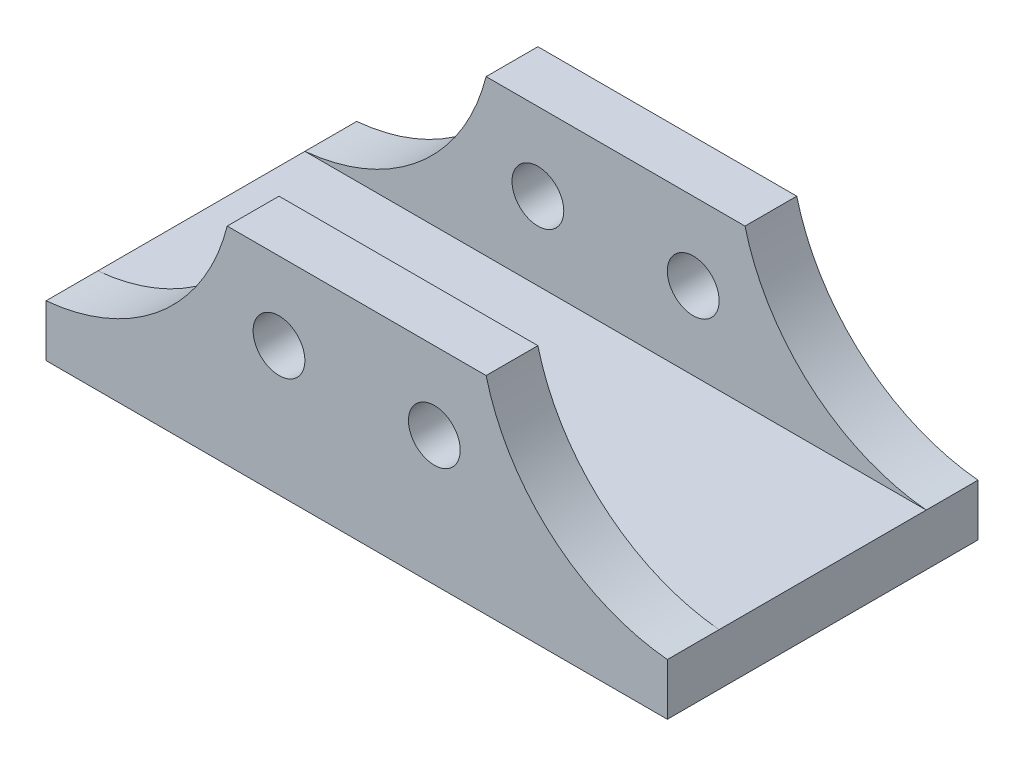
SolidWorks part; units mm, degrees
ref_plane "Front" through (0, 0, 0) normal (0, 0, 1) x (1, 0, 0)
ref_plane "Top" through (0, 0, 0) normal (0, 1, 0) x (1, 0, 0)
ref_plane "Right" through (0, 0, 0) normal (1, 0, 0) x (0, 0, -1)
sketch "Sketch1" plane through (0, 0, 0) normal (0, 0, 1) x (1, 0, 0)
  line L0 (-31.75, 38.1) -> (31.75, 38.1)
  line L1 (-76.2, 0) -> (76.2, 0) construction
  line L2 (-76.2, 0) -> (-76.2, -12.7)
  line L3 (-76.2, -12.7) -> (76.2, -12.7)
  line L4 (76.2, 0) -> (76.2, -12.7)
  line L5 (0, 0) -> (0, 38.1) construction
  line L6 (19.05, 19.05) -> (-19.05, 19.05) construction
  arc A0 (31.75, 38.1) -> (76.2, 0) centre (80.9949, 50.5732) ccw
  arc A1 (-31.75, 38.1) -> (-76.2, 0) centre (-80.9949, 50.5732) cw
  circle A2 centre (-19.05, 19.05) radius 6.35
  circle A3 centre (19.05, 19.05) radius 6.35
  point P15 (0, 19.05)
  dimension "D3" = 50.8
  dimension "D6" = 12.7
  dimension "D1" = 152.4
  dimension "D2" = 63.5
  dimension "D4" = 50.8
  dimension "D5" = 12.7
  dimension "D7" = 38.1
extrude "Extrude1" add sketch "Sketch1" along normal blind 12.7
sketch "Sketch2" plane through (0, 0, 12.7) normal (0, 0, 1) x (1, 0, 0)
  line L1 (-76.2, 0) -> (76.2, 0)
  line L2 (-76.2, 0) -> (-76.2, -12.7)
  line L3 (-76.2, -12.7) -> (76.2, -12.7)
  line L4 (76.2, 0) -> (76.2, -12.7)
extrude "Extrude2" add sketch "Sketch2" along normal blind 25.4
mirror "Mirror1" of "Extrude1", "Extrude2"
